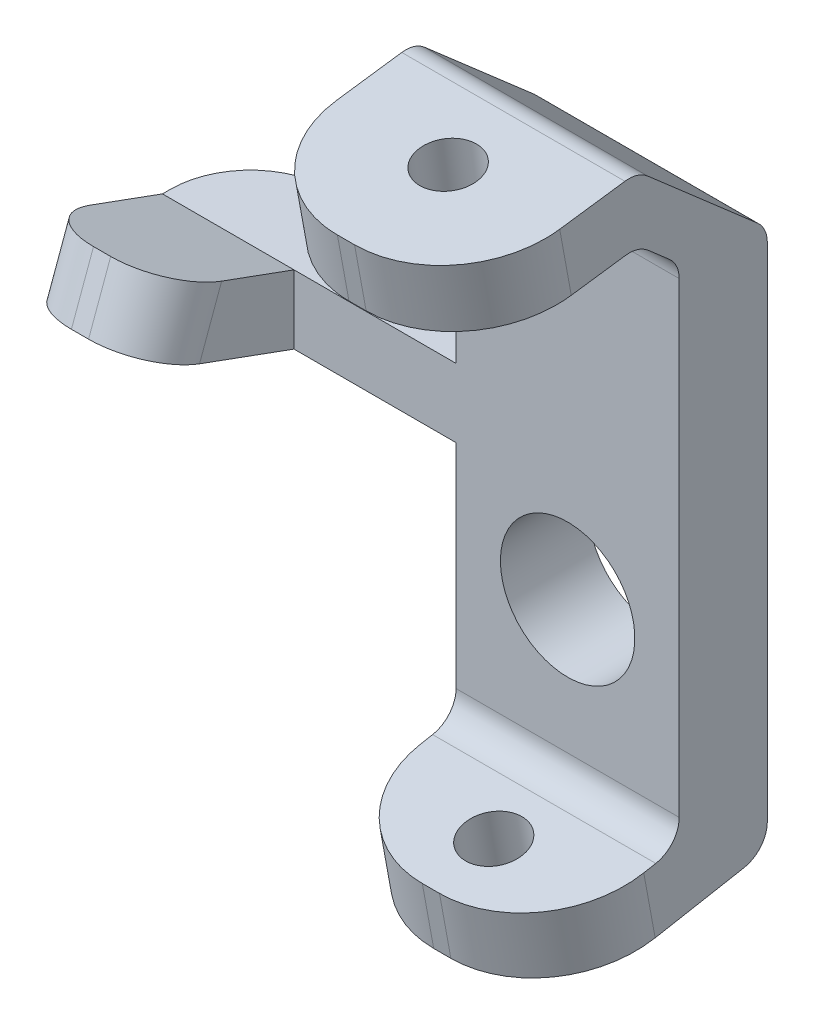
SolidWorks part; units mm, degrees
ref_plane "Front Plane" through (0, 0, 0) normal (0, 0, 1) x (1, 0, 0)
ref_plane "Top Plane" through (0, 0, 0) normal (0, 1, 0) x (1, 0, 0)
ref_plane "Right Plane" through (0, 0, 0) normal (1, 0, 0) x (0, 0, -1)
sketch "Sketch1" plane through (0, 0, 0) normal (0, 0, 1) x (1, 0, 0)
  circle A0 centre (0, 0) radius 14.9225
  dimension "D1" = 29.845
sketch3d "3DSketch1"
  line L0 (24.7675, 83.0072, 0) -> (-24.7675, 83.0072, 0)
  line L1 (-24.7675, 83.0072, 0) -> (-24.7675, -45.4152, 0)
  line L2 (24.7675, 83.0072, 0) -> (24.7675, -45.4152, 0)
  line L3 (24.7675, -45.4152, 0) -> (-24.7675, -45.4152, 0)
extrude "Main piece" add sketch "3DSketch1" along direction (0, 0, 1) on the side against the normal blind 19.558
extrude "Spindle Shaft hole" cut sketch "Sketch1" along normal through all contours A0
sketch3d "3DSketch3"
  line L0 (24.7675, -53.3415, 43.1851) -> (-24.7675, -53.3415, 43.1851)
  line L1 (-24.7675, -45.4152, 0) -> (24.7675, -45.4152, 0)
  line L2 (24.7675, -53.3415, 43.1851) -> (24.7675, -45.4152, 0)
  line L5 (-24.7675, -45.4152, 0) -> (-24.7675, -53.3415, 43.1851)
extrude "Bottom ball joint mount" add sketch "3DSketch3" along direction (0, -1, 0) on the side of the normal blind 14.224
sketch3d "3DSketch4"
  line L0 (0, 0, 0) -> (0, 59.944, 0)
  line L2 (24.7675, 59.944, 0) -> (-24.7675, 59.944, 0)
  line L3 (24.7675, -45.4152, 0) -> (24.7675, 83.0072, 0) construction
  line L4 (-24.7675, 83.0072, 0) -> (-24.7675, -45.4152, 0) construction
  line L5 (24.7675, 59.944, 0) -> (24.7675, 84.9884, 0)
  line L6 (24.7675, 84.9884, 0) -> (24.7675, 84.9884, 28.7528)
  line L7 (24.7675, 84.9884, 28.7528) -> (24.7675, 59.944, 0)
  line L8 (24.7675, 84.9884, 28.7528) -> (-24.7675, 84.9884, 28.7528)
  line L9 (-24.7675, 84.9884, 28.7528) -> (-24.7675, 59.944, 0)
  dimension "D1" = 59.944
  dimension "D2" = 25.0444
  dimension "D3" = 28.7528
extrude "Top arm" add sketch "3DSketch4" along direction (0, 1, 0) on the side of the normal blind 14.224 contours L8 L9 L2 L7
sketch "Sketch2" plane through (0, 42.1724, -36.7332) normal (0, 0.7541, -0.6568) x (1, 0, 0)
  line L1 (-30.4727, -76.1073) -> (33.53, -76.1073)
  line L2 (-30.4727, -76.1073) -> (-30.4727, -45.6489)
  line L3 (-30.4727, -45.6489) -> (33.53, -45.6489)
  line L4 (33.53, -76.1073) -> (33.53, -45.6489)
extrude "Top arm1" cut sketch "Sketch2" along normal blind 14.224
fillet "Fillet1" radius 6.35 2 edges at (0, 74.168, 0)
fillet "Fillet2" radius 6.35 1 edges at (0, 76.9795, 19.558)
fillet "Fillet3" radius 6.35 1 edges
sketch3d "3DSketch5"
  line L0 (-24.7675, 99.2124, 28.7528) -> (24.7675, 99.2124, 28.7528)
  line L1 (-24.7675, 99.2124, 28.7528) -> (-24.7675, 99.2124, 68.7578)
  line L2 (-24.7675, 99.2124, 68.7578) -> (-24.7675, 93.7514, 68.7578)
  line L3 (-24.7675, 99.2124, 28.7528) -> (-24.7675, 93.7514, 68.7578)
  line L4 (-24.7675, 93.7514, 68.7578) -> (24.7675, 93.7514, 68.7578)
  line L5 (24.7675, 99.2124, 28.7528) -> (24.7675, 93.7514, 68.7578)
  dimension "D1" = 40.005
  dimension "D2" = 5.461
extrude "Top ball joint mount" add sketch "3DSketch5" along direction (0, 0.9836, 0.1805) on the side against the normal blind 14.224 contours L5 L4 L3 L0
fillet "Fillet4" radius 6.35 1 edges at (0, 84.8874, 28.6368)
fillet "Fillet5" radius 6.35 5 edges
fillet "Fillet6" radius 6.35 1 edges at (0, -34.7809, 19.558)
fillet "Fillet7" radius 22.86 2 edges
sketch3d "3DSketch6"
  line L0 (0, 0, 0) -> (0, 25.4, 0) construction
  line L1 (0, 25.4, 0) -> (-89.9414, 25.4, 0) construction
  line L2 (-89.9414, 33.02, 0) -> (-89.9414, 17.78, 0)
  line L3 (0, 33.02, 0) -> (0, 17.78, 0)
  line L4 (-89.9414, 33.02, 0) -> (0, 33.02, 0)
  line L5 (0, 17.78, 0) -> (-89.9414, 17.78, 0)
  dimension "D1" = 25.4
  dimension "D2" = 89.9414
  dimension "D3" = 15.24
  dimension "D4" = 15.24
extrude "Tie rod arm" add sketch "3DSketch6" along direction (0, 0, -1) on the side of the normal blind 19.558
sketch3d "3DSketch7"
  line L0 (-89.9414, 33.02, 19.558) -> (-89.9414, 17.78, 19.558)
  line L4 (-89.9414, 33.02, 19.558) -> (-89.9414, 43.2406, 47.5596)
  line L5 (-89.9414, 43.2406, 47.5596) -> (-89.9414, 29.7922, 52.4682)
  line L6 (-89.9414, 29.7922, 52.4682) -> (-89.9414, 17.78, 19.558)
  line L7 (-89.9414, 17.78, 19.558) -> (-89.9414, 33.02, 19.558) construction
extrude "Tie rod mount" add sketch "3DSketch7" along direction (1, 0, 0) on the side of the normal blind 29.21
fillet "Fillet10" radius 12.7 2 edges
sketch3d "3DSketch8"
  line L0 (-24.7675, -39.1175, 43.1851) -> (-24.7675, -40.3514, 49.9074)
  line L1 (-24.7675, -35.736, 24.7616) -> (-24.7675, -39.1175, 43.1851) construction
  line L2 (-24.7675, -40.3514, 49.9074) -> (-24.7675, -54.1118, 47.3818)
  line L3 (-24.7675, -53.3415, 43.1851) -> (-24.7675, -54.1118, 47.3818)
  line L4 (-24.7675, -46.3703, 5.2036) -> (-24.7675, -53.3415, 43.1851) construction
  line L5 (-24.7675, -39.1175, 43.1851) -> (-24.7675, -53.3415, 43.1851)
extrude "Bottom ball joint mount extension" add sketch "3DSketch8" along direction (1, 0, 0) on the side against the normal blind 49.5351
fillet "Fillet11" radius 22.86 6 edges
fillet "Fillet12" radius 17.78 1 edges
sketch "Sketch3" plane through (0, 101.2506, 13.8215) normal (0, 0.9908, 0.1353) x (1, 0, 0)
  circle A0 centre (0, -32.5617) radius 6.35
  dimension "D1" = 12.7
extrude "Cut-Extrude1" cut sketch "Sketch3" against normal blind 50.8
sketch "Sketch4" plane through (0, -30.1747, -5.5384) normal (0, 0.9836, 0.1805) x (1, 0, 0)
  circle A0 centre (0, -42.1824) radius 6.35
  dimension "D1" = 12.7
extrude "Cut-Extrude2" cut sketch "Sketch4" against normal blind 50.8
